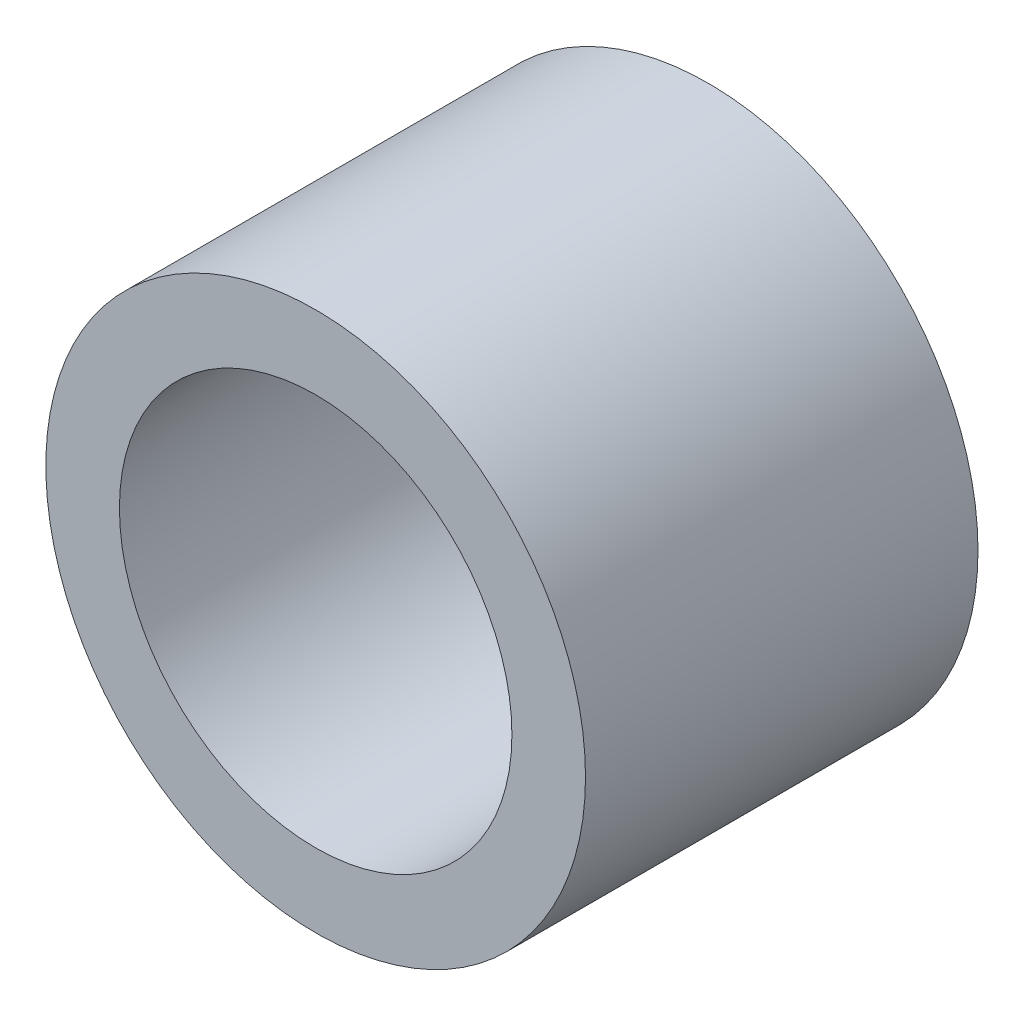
SolidWorks part; units mm, degrees
ref_plane "Face" through (0, 0, 0) normal (0, 0, 1) x (1, 0, 0)
ref_plane "Dessus" through (0, 0, 0) normal (0, 1, 0) x (1, 0, 0)
ref_plane "Droite" through (0, 0, 0) normal (1, 0, 0) x (0, 0, -1)
sketch "Esquisse1" plane through (0, 0, 0) normal (0, 0, 1) x (1, 0, 0)
  circle A0 centre (0, 0) radius 8
  circle A1 centre (0, 0) radius 11
  dimension "D1" = 16
  dimension "D2" = 22
extrude "Base-Extrusion" add sketch "Esquisse1" along normal blind 16
